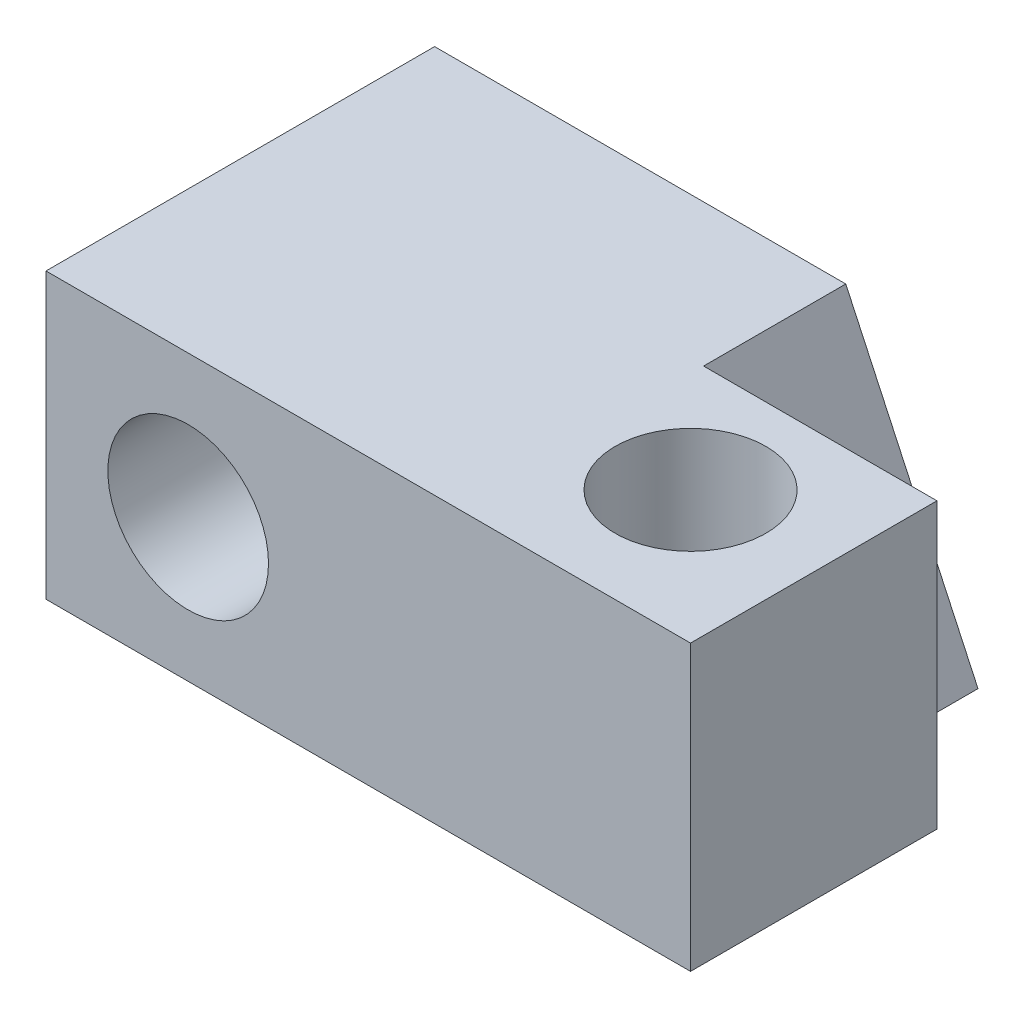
SolidWorks part; units mm, degrees
ref_plane "Front" through (0, 0, 0) normal (0, 0, 1) x (1, 0, 0)
ref_plane "Top" through (0, 0, 0) normal (0, 1, 0) x (1, 0, 0)
ref_plane "Right" through (0, 0, 0) normal (1, 0, 0) x (0, 0, -1)
sketch "Sketch1" plane through (0, 0, 0) normal (0, 0, 1) x (1, 0, 0)
  line L1 (0, 0) -> (17.272, 0)
  line L2 (0, 0) -> (0, 7.62)
  line L3 (0, 7.62) -> (17.272, 7.62)
  line L4 (17.272, 0) -> (17.272, 7.62)
  dimension "D1" = 7.62
  dimension "D2" = 17.272
extrude "Extrude1" add sketch "Sketch1" along normal blind 10.414
hole_wizard "#10-32 Tapped Hole1" positions "Sketch3" profile "Sketch2" tap size "#10-32" standard "Ansi Inch"
sketch "Sketch3" plane through (0, 0, 0) normal (0, -1, 0) x (1, 0, 0)
  line L0 (13.716, 6.858) -> (17.272, 10.414) construction
  line L1 (0, 10.414) -> (17.272, 10.414) construction
  point P0 (13.716, 6.858)
  dimension "D1" = 45
  dimension "D2" = 3.556
sketch "Sketch2" plane through (13.716, 0, 6.858) normal (1, 0, 0) x (0, 0, -1)
  line L0 (0, 0) -> (0, 7.62)
  line L1 (0, 7.62) -> (2.0193, 7.62)
  line L2 (2.0193, 7.62) -> (2.0193, 0)
  line L5 (2.0193, 0) -> (0, 0)
  line L11 (0, -6.35) -> (0, 107.95) construction
  dimension "Thru Tap Drill Dia." = 4.0386
  dimension "Thru Tap Drill Depth" = 7.62
hole_wizard "#18 (0.169500) Diameter Hole1" positions "Sketch6" profile "Sketch5" hole size "#18" standard "Ansi Inch"
sketch "Sketch6" plane through (0, 0, 10.414) normal (0, 0, 1) x (1, 0, 0)
  line L0 (3.81, 7.62) -> (3.81, 0) construction
  line L1 (17.272, 7.62) -> (0, 7.62) construction
  line L2 (0, 0) -> (17.272, 0) construction
  line L3 (0, 7.62) -> (0, 0) construction
  point P0 (3.81, 3.81)
  dimension "D1" = 3.81
sketch "Sketch5" plane through (3.81, 3.81, 10.414) normal (1, 0, 0) x (0, -1, 0)
  line L0 (0, 0) -> (0, 10.414)
  line L1 (0, 10.414) -> (2.1526, 10.414)
  line L2 (2.1526, 10.414) -> (2.1526, 0)
  line L5 (2.1526, 0) -> (0, 0)
  line L11 (0, -6.35) -> (0, 107.95) construction
  dimension "Thru Hole Dia." = 4.3053
  dimension "Thru Hole Depth" = 10.414
hole_wizard "1/8 (0.125000) Diameter Hole1" positions "Sketch8" profile "Sketch7" hole size "1/8" standard "Ansi Inch"
sketch "Sketch8" plane through (0, 0, 0) normal (0, 0, -1) x (-1, 0, 0)
  line L0 (0, 0) -> (-17.272, 0) construction
  point P0 (-9.779, 2.54)
  dimension "D1" = 9.779
  dimension "D2" = 2.54
sketch "Sketch7" plane through (9.779, 2.54, 0) normal (1, 0, 0) x (0, 1, 0)
  line L0 (0, 0) -> (0, 6.0339)
  line L1 (0, 6.0339) -> (1.5875, 5.08)
  line L2 (1.5875, 5.08) -> (1.5875, 0)
  line L5 (1.5875, 0) -> (0, 0)
  line L10 (0, 6.0339) -> (-1.5875, 5.08) construction
  line L11 (0, -6.35) -> (0, 107.95) construction
  dimension "Hole Dia." = 3.175
  dimension "Hole Depth" = 5.08
  dimension "Drill Angle" = 118
sketch "Sketch9" plane through (0, 0, 0) normal (0, 0, -1) x (-1, 0, 0)
  line L0 (-11.0182, 7.62) -> (-14.5617, 0)
  line L1 (-17.272, 7.62) -> (0, 7.62) construction
  line L2 (0, 0) -> (-17.272, 0) construction
  line L3 (0, 7.62) -> (0, 0) construction
  line L4 (-11.0182, 7.62) -> (-17.272, 7.62)
  line L5 (-17.272, 7.62) -> (-17.272, 0)
  line L7 (-17.272, 0) -> (-14.5617, 0)
  dimension "D1" = 11.0182
  dimension "D2" = 245.061
  dimension "D3" = 17.272
extrude "Cut-Extrude1" cut sketch "Sketch9" against normal blind 3.81
